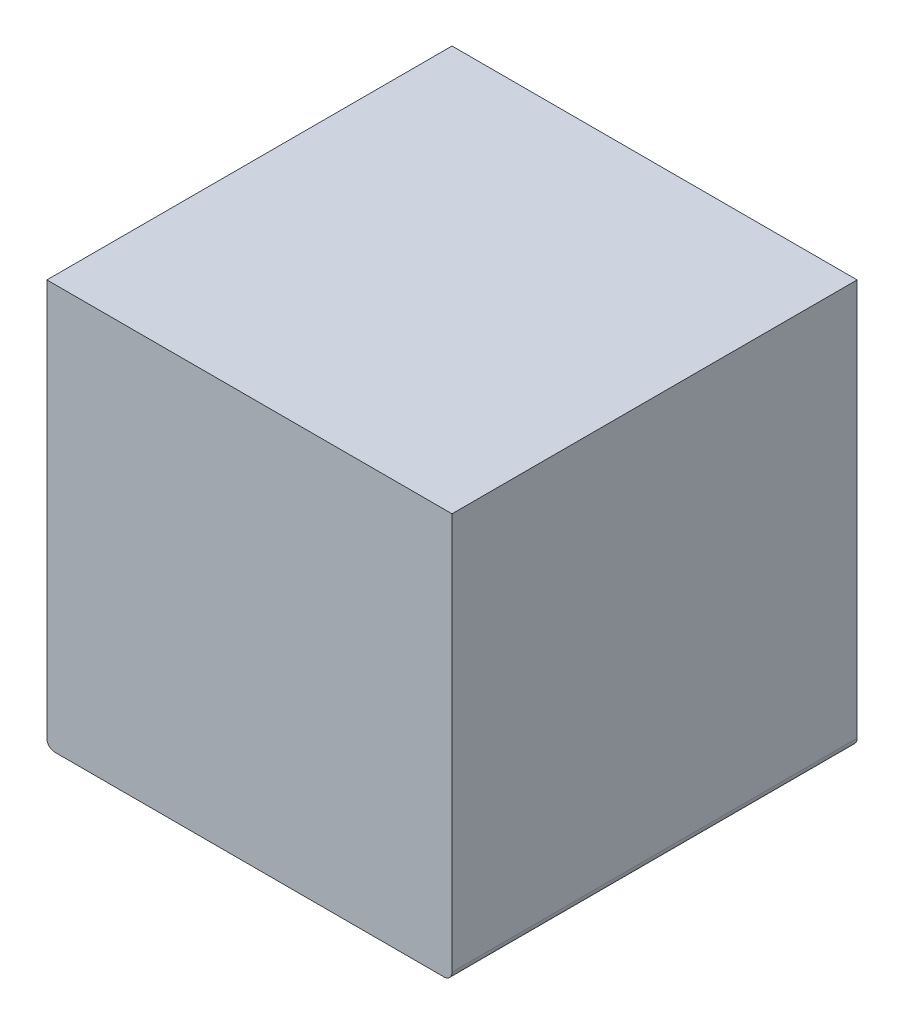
SolidWorks part; units mm, degrees
ref_plane "Front" through (0, 0, 0) normal (0, 0, 1) x (1, 0, 0)
ref_plane "Top" through (0, 0, 0) normal (0, 1, 0) x (1, 0, 0)
ref_plane "Right" through (0, 0, 0) normal (1, 0, 0) x (0, 0, -1)
sketch "Sketch1" plane through (0, 0, 0) normal (0, 1, 0) x (1, 0, 0)
  line L1 (50, -50) -> (-50, -50)
  line L2 (50, -50) -> (50, 50)
  line L3 (50, 50) -> (-50, 50)
  line L4 (-50, -50) -> (-50, 50)
  line L5 (50, -50) -> (-50, 50) construction
  line L6 (50, 50) -> (-50, -50) construction
  point P0 (0, 0)
  dimension "D1" = 100
  dimension "D2" = 100
extrude "Boss-Extrude1" add sketch "Sketch1" along normal blind 100
fillet "Fillet1" radius 2 2 edges at (-50, 0, 0) (50, 0, 0)
